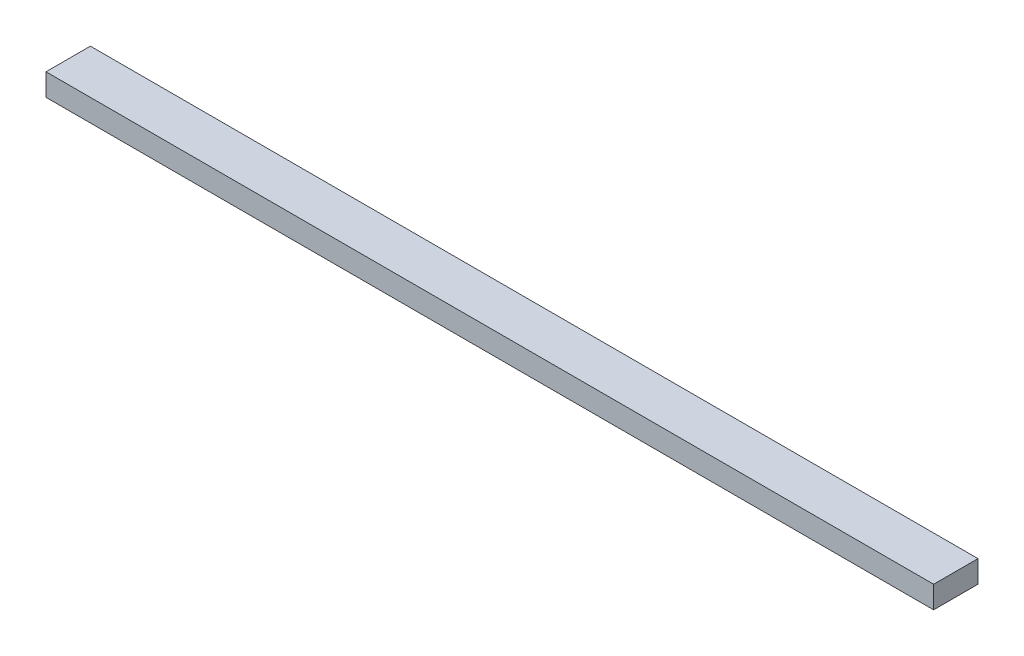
SolidWorks part; units mm, degrees
ref_plane "Front Plane" through (0, 0, 0) normal (0, 0, 1) x (1, 0, 0)
ref_plane "Top Plane" through (0, 0, 0) normal (0, 1, 0) x (1, 0, 0)
ref_plane "Right Plane" through (0, 0, 0) normal (1, 0, 0) x (0, 0, -1)
sketch "Sketch1" plane through (0, 0, 0) normal (0, 1, 0) x (1, 0, 0)
  line L1 (10000, -500) -> (-10000, -500)
  line L2 (10000, -500) -> (10000, 500)
  line L3 (10000, 500) -> (-10000, 500)
  line L4 (-10000, -500) -> (-10000, 500)
  line L5 (10000, -500) -> (-10000, 500) construction
  line L6 (10000, 500) -> (-10000, -500) construction
  point P0 (0, 0)
  dimension "D1" = 1000
  dimension "D2" = 20000
extrude "Boss-Extrude1" add sketch "Sketch1" along normal blind 500
